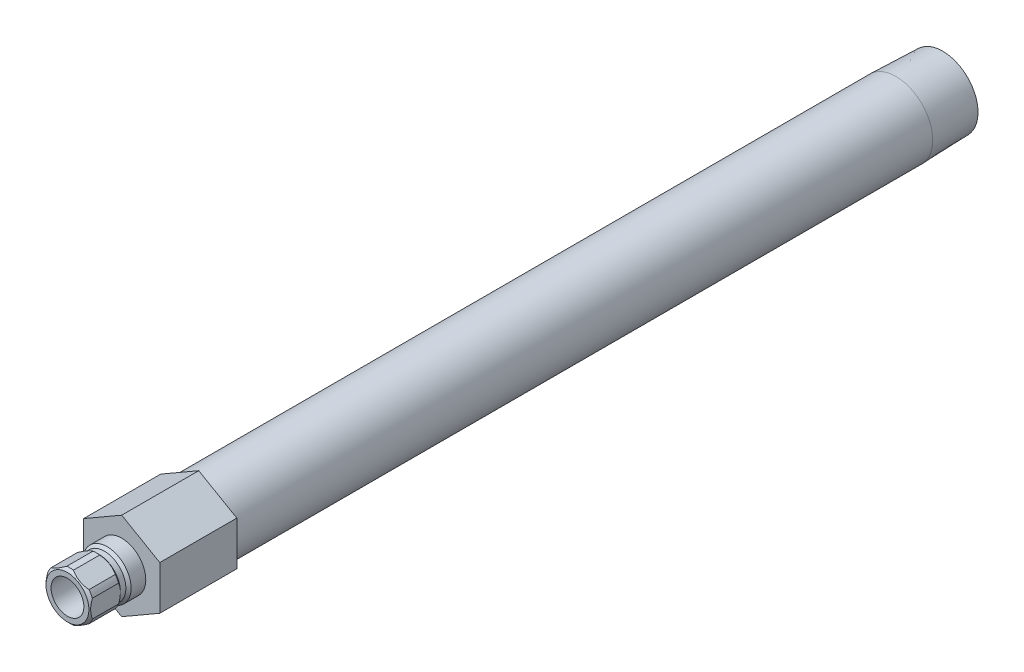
SolidWorks part; units mm, degrees
ref_plane "Front Plane" through (0, 0, 0) normal (0, 0, 1) x (1, 0, 0)
ref_plane "Top Plane" through (0, 0, 0) normal (0, 1, 0) x (1, 0, 0)
ref_plane "Right Plane" through (0, 0, 0) normal (1, 0, 0) x (0, 0, -1)
sketch "Sketch1" plane through (0, 0, 0) normal (1, 0, 0) x (0, 0, -1)
  line L0 (-13.1224, 0) -> (-18.923, 0) construction
  line L1 (-15.748, 4.7625) -> (-15.748, 6.223)
  line L2 (-6.604, 6.223) -> (-6.604, 0) construction
  line L3 (-14.986, 6.985) -> (-7.366, 6.985)
  line L5 (-6.604, 6.223) -> (-5.0165, 6.223)
  line L6 (-4.2545, 6.985) -> (0, 6.985)
  line L7 (0, 6.985) -> (0, 10.668)
  line L8 (-6.604, 6.223) -> (-7.366, 6.985)
  line L9 (-5.0165, 6.223) -> (-4.2545, 6.985)
  line L10 (-15.748, 6.223) -> (-14.986, 6.985)
  line L11 (-15.748, 4.7625) -> (22.352, 4.7625)
  line L12 (0, 10.668) -> (224.6884, 10.668)
  line L13 (224.6884, 10.668) -> (238.252, 10.2441)
  line L14 (238.252, 10.2441) -> (238.252, 7.8994)
  line L15 (0, 6.985) -> (22.352, 6.985) construction
  line L16 (22.352, 6.985) -> (22.352, 0) construction
  line L17 (22.352, 0) -> (-13.1224, 0) construction
  line L18 (22.352, 4.7625) -> (22.352, 7.8994)
  line L19 (22.352, 7.8994) -> (238.252, 7.8994)
  dimension "D1" = 15.748
  dimension "D2" = 1.5875
  dimension "D3" = 0.762
  dimension "D4" = 45
  dimension "D5" = 9.144
  dimension "D6" = 45
  dimension "D7" = 1.79
  dimension "D8" = 13.5636
  dimension "D9" = 254
  dimension "D10" = 3.175
  dimension "D11" = 9.525
  dimension "D12" = 21.336
  dimension "D13" = 38.1
  dimension "D14" = 13.97
  dimension "D15" = 15.7988
revolve "Revolve1" add sketch "Sketch1" angle 360 about L0
sketch "Sketch2" plane through (0, 0, 0) normal (0, 0, 1) x (1, 0, 0)
  line L1 (-11.049, 6.3791) -> (-11.049, -6.3791)
  line L2 (-11.049, -6.3791) -> (0, -12.7583)
  line L3 (0, -12.7583) -> (11.049, -6.3791)
  line L4 (11.049, -6.3791) -> (11.049, 6.3791)
  line L5 (11.049, 6.3791) -> (0, 12.7583)
  line L6 (0, 12.7583) -> (-11.049, 6.3791)
  circle A0 centre (0, 0) radius 11.049 construction
  circle A1 centre (0, 0) radius 4.7625 construction
  circle A2 centre (0, 0) radius 4.7625
  dimension "D1" = 22.098
extrude "Boss-Extrude1" add sketch "Sketch2" against normal up to vertex (22.352 mm away) from vertex at 0
sketch "Sketch3" plane through (0, 0, 0) normal (0, 0, 1) x (1, 0, 0)
  line L1 (6.477, -3.7395) -> (6.477, 3.7395)
  line L2 (6.477, 3.7395) -> (0, 7.479)
  line L3 (0, 7.479) -> (-6.477, 3.7395)
  line L4 (-6.477, 3.7395) -> (-6.477, -3.7395)
  line L5 (-6.477, -3.7395) -> (0, -7.479)
  line L6 (0, -7.479) -> (6.477, -3.7395)
  circle A0 centre (0, 0) radius 6.477 construction
  dimension "D1" = 12.954
extrude "Cut-Extrude1" cut sketch "Sketch3" along normal through all from vertex at 6.604 flip side to cut
